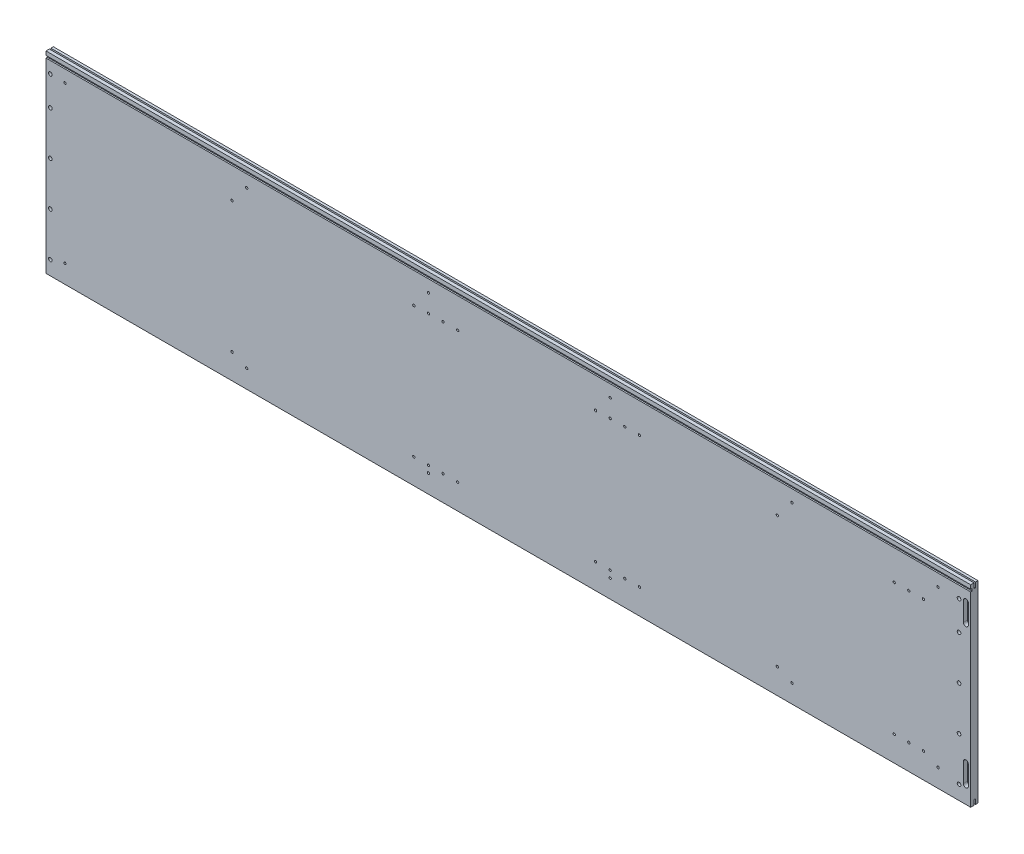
SolidWorks part; units mm, degrees
ref_plane "Ebene vorne" through (0, 0, 0) normal (0, 0, 1) x (1, 0, 0)
ref_plane "Ebene oben" through (0, 0, 0) normal (0, 1, 0) x (1, 0, 0)
ref_plane "Ebene rechts" through (0, 0, 0) normal (1, 0, 0) x (0, 0, -1)
sketch "Skizze1" plane through (0, 0, 0) normal (0, 0, 1) x (1, 0, 0)
  line L1 (-1012.5, -211) -> (1012.5, -211)
  line L2 (-1012.5, -211) -> (-1012.5, 211)
  line L3 (-1012.5, 211) -> (1012.5, 211)
  line L4 (1012.5, -211) -> (1012.5, 211)
  line L5 (-1012.5, -211) -> (1012.5, 211) construction
  line L6 (-1012.5, 211) -> (1012.5, -211) construction
  point P0 (0, 0)
  dimension "D1" = 2025
  dimension "D2" = 422
extrude "Aufsatz-Linear austragen1" add sketch "Skizze1" along normal blind 16
hole_wizard "Ø8.0 (8) Durchmesser Bohrung1 Dübel" positions "Skizze3" profile "Skizze2" hole size "Ø8.0" standard "Din"
sketch "Skizze3" plane through (0, 0, 16) normal (0, 0, 1) x (1, 0, 0)
  line L0 (1012.5, 211) -> (-1012.5, 211) construction
  line L1 (-1012.5, 211) -> (-1012.5, -211) construction
  line L2 (1012.5, -211) -> (1012.5, 211) construction
  point P0 (987, 172)
  point P2 (987, 108)
  point P4 (987, 12)
  point P6 (987, -84)
  point P8 (987, -180)
  point P10 (-1003, 172)
  point P12 (-1003, 108)
  point P14 (-1003, 12)
  point P16 (-1003, -84)
  point P18 (-1003, -180)
  dimension "D1" = 39
  dimension "D2" = 64
  dimension "D3" = 96
  dimension "D4" = 96
  dimension "D5" = 96
  dimension "D6" = 9.5
  dimension "D7" = 25.5
sketch "Skizze2" plane through (987, 172, 16) normal (1, 0, 0) x (0, -1, 0)
  line L0 (0, 0) -> (0, 13.4034)
  line L1 (0, 13.4034) -> (4, 11)
  line L2 (4, 11) -> (4, 0)
  line L5 (4, 0) -> (0, 0)
  line L10 (0, 13.4034) -> (-4, 11) construction
  line L11 (0, -6.35) -> (0, 107.95) construction
  dimension "Bohrerdurchmesser" = 8
  dimension "Bohrungstiefe" = 11
  dimension "Spitzenwinkel" = 118
sketch "Skizze4" plane through (-1012.5, 0, 0) normal (-1, 0, 0) x (0, 0, 1)
  line L0 (16, 202.5) -> (13, 202.5)
  line L1 (16, 211) -> (16, -211) construction
  line L2 (13, 202.5) -> (13, 197.5)
  line L3 (13, 197.5) -> (16, 197.5)
  line L4 (16, 197.5) -> (16, 202.5)
  line L5 (16, 211) -> (0, 211) construction
  dimension "D1" = 13.5
  dimension "D2" = 5
  dimension "D3" = 3
extrude "Schnitt-Linear austragen1 RW-Nut" cut sketch "Skizze4" against normal through all
sketch "Skizze7" plane through (1012.5, 0, 0) normal (1, 0, 0) x (0, 0, -1)
  line L0 (-8.7, 211) -> (-8.7, 200)
  line L1 (-16, 211) -> (0, 211) construction
  line L2 (-8.7, 200) -> (-5.5, 200)
  line L3 (-5.5, 200) -> (-5.5, 211)
  line L4 (-5.5, 211) -> (-8.7, 211)
  line L5 (-16, 202.5) -> (-16, 211) construction
  dimension "D1" = 7.3
  dimension "D2" = 3.2
  dimension "D3" = 11
extrude "Schnitt-Linear austragen3 Alu-Profil-Nut" cut sketch "Skizze7" against normal through all
ref_plane "Ebene1" through (0, 0, 0) normal (0, 1, 0) x (1, 0, 0)
mirror "Spiegeln1" about plane through (0, 0, 0) normal (0, 1, 0) of "Schnitt-Linear austragen3 Alu-Profil-Nut"
sketch "Skizze9" plane through (0, 0, 16) normal (0, 0, 1) x (1, 0, 0)
  line L0 (1001.9, 174) -> (1001.9, 131.8) construction
  line L1 (1007.3, 174) -> (1007.3, 131.8)
  line L2 (996.5, 174) -> (996.5, 131.8)
  line L3 (1001.9, -131.8) -> (1001.9, -174) construction
  line L4 (1007.3, -131.8) -> (1007.3, -174)
  line L5 (996.5, -131.8) -> (996.5, -174)
  line L6 (1012.5, 211) -> (-1012.5, 211) construction
  line L7 (-1012.5, -211) -> (1012.5, -211) construction
  line L8 (1012.5, -211) -> (1012.5, 197.5) construction
  arc A0 (1007.3, 174) -> (996.5, 174) centre (1001.9, 174) ccw
  arc A1 (996.5, 131.8) -> (1007.3, 131.8) centre (1001.9, 131.8) ccw
  arc A2 (1007.3, -131.8) -> (996.5, -131.8) centre (1001.9, -131.8) ccw
  arc A3 (996.5, -174) -> (1007.3, -174) centre (1001.9, -174) ccw
  point P2 (1001.9, 152.9)
  point P7 (1001.9, -152.9)
  dimension "D1" = 10.8
  dimension "D2" = 53
  dimension "D3" = 10.8
  dimension "D4" = 53
  dimension "D5" = 37
  dimension "D6" = 37
  dimension "D7" = 16
extrude "Schnitt-Linear austragen4 Höhenversteller" cut sketch "Skizze9" against normal blind 9
hole_wizard "Ø5.0 (5) Durchmesser Bohrung1 Mittelboden" positions "Skizze11" profile "Skizze10" hole size "Ø5.0" standard "Din"
sketch "Skizze11" plane through (0, 0, 16) normal (0, 0, 1) x (1, 0, 0)
  line L0 (1012.5, -211) -> (1012.5, 197.5) construction
  line L1 (-1012.5, -211) -> (1012.5, -211) construction
  point P2 (589, 131)
  point P4 (191, 131)
  point P6 (-207, 131)
  point P8 (-207, -156)
  point P10 (191, -156)
  point P12 (589, -156)
  point P25 (-605, 131)
  point P27 (-605, -156)
  dimension "D1" = 423.5
  dimension "D2" = 398
  dimension "D3" = 398
  dimension "D4" = 398
  dimension "D5" = 55
  dimension "D6" = 287
sketch "Skizze10" plane through (589, 131, 16) normal (1, 0, 0) x (0, -1, 0)
  line L0 (0, 0) -> (0, 13.5022)
  line L1 (0, 13.5022) -> (2.5, 12)
  line L2 (2.5, 12) -> (2.5, 0)
  line L5 (2.5, 0) -> (0, 0)
  line L10 (0, 13.5022) -> (-2.5, 12) construction
  line L11 (0, -6.35) -> (0, 107.95) construction
  dimension "Bohrerdurchmesser" = 5
  dimension "Bohrungstiefe" = 12
  dimension "Spitzenwinkel" = 118
hole_wizard "Ø5.0 (5) Durchmesser Bohrung2 Verbinder" positions "Skizze13" profile "Skizze12" hole size "Ø5.0" standard "Din"
sketch "Skizze13" plane through (0, 0, 16) normal (0, 0, 1) x (1, 0, 0)
  line L0 (1012.5, -211) -> (1012.5, 197.5) construction
  line L1 (1012.5, 211) -> (-1012.5, 211) construction
  line L2 (-1012.5, -211) -> (1012.5, -211) construction
  line L4 (-1012.5, 197.5) -> (-1012.5, -211) construction
  point P0 (941, 171)
  point P2 (621, 171)
  point P4 (223, 171)
  point P6 (-175, 171)
  point P8 (-573, 171)
  point P10 (-971, 171)
  point P12 (-971, -171)
  point P14 (-573, -171)
  point P16 (-175, -171)
  point P18 (223, -171)
  point P20 (621, -171)
  point P22 (941, -171)
  dimension "D1" = 71.5
  dimension "D2" = 40
  dimension "D3" = 40
  dimension "D4" = 320
  dimension "D5" = 398
  dimension "D6" = 398
  dimension "D7" = 398
  dimension "D8" = 398
  dimension "D9" = 41.5
sketch "Skizze12" plane through (941, 171, 16) normal (1, 0, 0) x (0, -1, 0)
  line L0 (0, 0) -> (0, 16)
  line L1 (0, 16) -> (2.5, 16)
  line L2 (2.5, 16) -> (2.5, 0)
  line L5 (2.5, 0) -> (0, 0)
  line L11 (0, -6.35) -> (0, 107.95) construction
  dimension "Bohrerdurchmesser" = 5
  dimension "Bohrungstiefe" = 16
sketch "Skizze15" plane through (0, -200, 0) normal (0, -1, 0) x (1, 0, 0)
  line L0 (-1012.5, 8.7) -> (-1004.1348, 8.7)
  line L1 (-1012.5, 8.7) -> (1012.5, 8.7) construction
  line L2 (-1004.1348, 8.7) -> (-1004.1348, 5.5)
  line L3 (-1012.5, 5.5) -> (1012.5, 5.5) construction
  line L4 (-1004.1348, 5.5) -> (-1012.5, 5.5)
  line L5 (-1012.5, 5.5) -> (-1012.5, 8.7)
  dimension "D1" = 8.3652
extrude "Schnitt-Linear austragen1Alu-Profil-Nut" cut sketch "Skizze15" against normal through all
hole_wizard "Ø5.0 (5) Durchmesser Bohrung1" positions "Skizze17" profile "Skizze16" hole size "Ø5.0" standard "Din"
sketch "Skizze17" plane through (0, 0, 16) normal (0, 0, 1) x (1, 0, 0)
  line L0 (1012.5, -211) -> (1012.5, 197.5) construction
  line L1 (-1012.5, -211) -> (1012.5, -211) construction
  point P0 (909, 132)
  point P2 (877, 132)
  point P4 (845, 132)
  point P6 (845, -156)
  point P8 (877, -156)
  point P10 (909, -156)
  point P19 (-175, 132)
  point P21 (-143, 132)
  point P23 (-111, 132)
  point P25 (-111, -156)
  point P27 (-143, -156)
  point P29 (-175, -156)
  point P38 (223, 132)
  point P40 (255, 132)
  point P42 (287, 132)
  point P44 (287, -156)
  point P46 (255, -156)
  point P48 (223, -156)
  dimension "D1" = 32
  dimension "D2" = 32
  dimension "D3" = 103.5
  dimension "D4" = 55
  dimension "D5" = 343
  dimension "D6" = 32
  dimension "D7" = 32
  dimension "D8" = 32
  dimension "D9" = 32
  dimension "D10" = 32
  dimension "D11" = 32
sketch "Skizze16" plane through (909, 132, 16) normal (1, 0, 0) x (0, -1, 0)
  line L0 (0, 0) -> (0, 8.5022)
  line L1 (0, 8.5022) -> (2.5, 7)
  line L2 (2.5, 7) -> (2.5, 0)
  line L5 (2.5, 0) -> (0, 0)
  line L10 (0, 8.5022) -> (-2.5, 7) construction
  line L11 (0, -6.35) -> (0, 107.95) construction
  dimension "Bohrerdurchmesser" = 5
  dimension "Bohrungstiefe" = 7
  dimension "Spitzenwinkel" = 118
